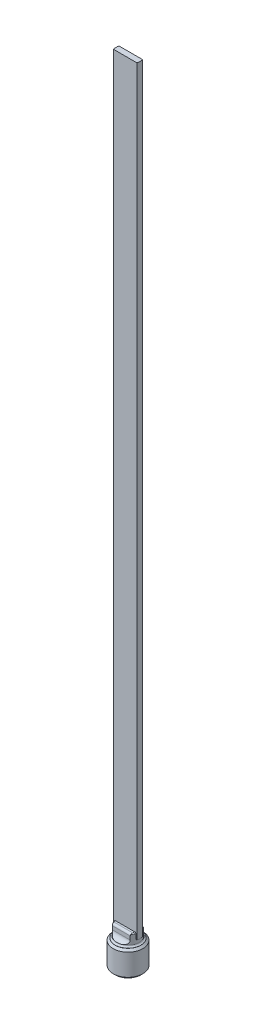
SolidWorks part; units mm, degrees
other "Cut-Extrude1"
ref_plane "Front Plane" through (0, 0, 0) normal (0, 0, 1) x (1, 0, 0)
ref_plane "Top Plane" through (0, 0, 0) normal (0, 1, 0) x (1, 0, 0)
ref_plane "Right Plane" through (0, 0, 0) normal (1, 0, 0) x (0, 0, -1)
imported_body "Imported1"
sketch "Sketch1" plane through (0, 8.001, 0) normal (0, 1, 0) x (1, 0, 0)
  line L0 (-3.0261, 0.7239) -> (3.0261, 0.7239)
  line L1 (3.0261, -0.7239) -> (-3.0261, -0.7239)
  line L2 (2.7643, 0.7239) -> (-2.7643, 0.7239) construction
  line L3 (-2.7643, -0.7239) -> (2.7643, -0.7239) construction
  arc A0 (-3.0261, 0.7239) -> (-3.0261, -0.7239) centre (0, 0) ccw
  arc A1 (3.0261, -0.7239) -> (3.0261, 0.7239) centre (0, 0) ccw
  dimension "D1" = 6.223
extrude "Boss-Extrude1" add sketch "Sketch1" along normal offset from surface (195.199 mm away) 203.2
